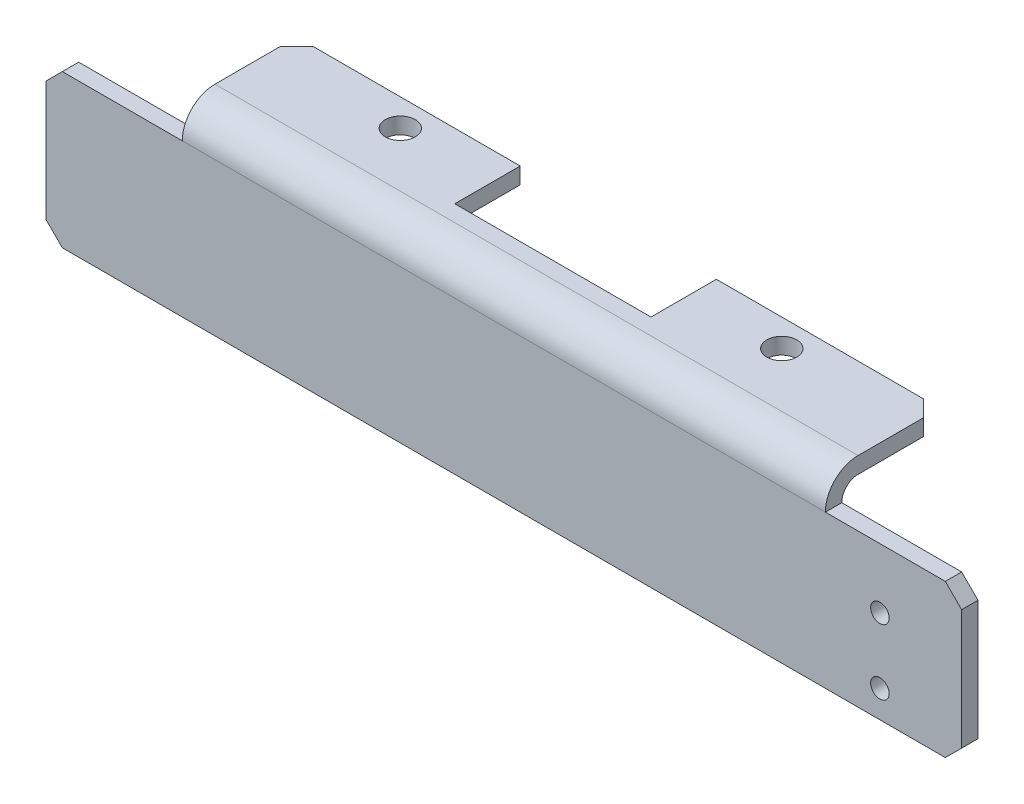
SolidWorks part; units mm, degrees
ref_plane "Спереди" through (0, 0, 0) normal (0, 0, 1) x (1, 0, 0)
ref_plane "Сверху" through (0, 0, 0) normal (0, 1, 0) x (1, 0, 0)
ref_plane "Справа" through (0, 0, 0) normal (1, 0, 0) x (0, 0, -1)
sketch "Эскиз1" plane through (0, 0, 0) normal (1, 0, 0) x (0, 0, -1)
  line L0 (-3.3726, 1.9815) -> (-3.3726, -26.0185)
  line L2 (-0.3726, 1.9815) -> (-0.3726, -26.0185)
  line L3 (-0.3726, -26.0185) -> (-3.3726, -26.0185)
  line L5 (2.6274, 4.9815) -> (17.6274, 4.9815)
  line L7 (2.6274, 7.9815) -> (17.6274, 7.9815)
  line L8 (17.6274, 4.9815) -> (17.6274, 7.9815)
  arc A0 (2.6274, 4.9815) -> (-0.3726, 1.9815) centre (2.6274, 1.9815) ccw
  arc A1 (2.6274, 7.9815) -> (-3.3726, 1.9815) centre (2.6274, 1.9815) ccw
  point P10 (-3.3726, 7.9815)
  dimension "D1" = 3
  dimension "D6" = 6
  dimension "D7" = 26.0185
  dimension "D2" = 3
  dimension "D3" = 3
  dimension "D4" = 34
  dimension "D5" = 21
  dimension "D8" = 0.3726
extrude "Бобышка-Вытянуть1" add sketch "Эскиз1" along normal blind 168
sketch "Эскиз2" plane through (0, 7.9815, 0) normal (0, 1, 0) x (1, 0, 0)
  line L0 (143, 17.6274) -> (168, 17.6274)
  line L1 (168, 17.6274) -> (0, 17.6274) construction
  line L2 (168, 17.6274) -> (168, -3.3726)
  line L3 (168, -3.3726) -> (143, -3.3726)
  line L4 (168, -3.3726) -> (0, -3.3726) construction
  line L5 (143, -3.3726) -> (143, 17.6274)
  line L6 (0, 17.6274) -> (25, 17.6274)
  line L7 (25, 17.6274) -> (25, -3.3726)
  line L8 (25, -3.3726) -> (0, -3.3726)
  line L9 (0, -3.3726) -> (0, 17.6274)
  dimension "D1" = 25
  dimension "D2" = 25
extrude "Вырез-Вытянуть1" cut sketch "Эскиз2" against normal blind 6
sketch "Эскиз3" plane through (0, 7.9815, 0) normal (0, 1, 0) x (1, 0, 0)
  line L0 (66, 17.6274) -> (102, 17.6274)
  line L1 (143, 17.6274) -> (25, 17.6274) construction
  line L2 (102, 17.6274) -> (102, 5.6274)
  line L3 (102, 5.6274) -> (66, 5.6274)
  line L4 (66, 5.6274) -> (66, 17.6274)
  line L5 (25, 2.6274) -> (25, 17.6274) construction
  dimension "D1" = 36
  dimension "D2" = 12
  dimension "D3" = 41
extrude "Вырез-Вытянуть2" cut sketch "Эскиз3" against normal blind 6
sketch "Эскиз4" plane through (0, 7.9815, 0) normal (0, 1, 0) x (1, 0, 0)
  line L0 (143, 17.6274) -> (102, 17.6274) construction
  line L1 (66, 17.6274) -> (25, 17.6274) construction
  line L2 (25, 2.6274) -> (25, 17.6274) construction
  circle A0 centre (49, 12.6274) radius 2.75
  circle A1 centre (119, 12.6274) radius 2.75
  dimension "D1" = 5.5
  dimension "D3" = 5.5
  dimension "D2" = 5
  dimension "D4" = 5
  dimension "D5" = 24
  dimension "D6" = 70
extrude "Вырез-Вытянуть3" cut sketch "Эскиз4" against normal blind 6
sketch "Эскиз5" plane through (0, 0, 3.3726) normal (0, 0, 1) x (1, 0, 0)
  line L0 (168, 1.9815) -> (168, -26.0185) construction
  line L1 (168, -26.0185) -> (0, -26.0185) construction
  circle A0 centre (153, -21.0185) radius 1.7
  circle A1 centre (153, -9.0185) radius 1.7
  dimension "D1" = 3.4
  dimension "D2" = 3.4
  dimension "D3" = 15
  dimension "D4" = 15
  dimension "D5" = 12
  dimension "D6" = 5
extrude "Вырез-Вытянуть4" cut sketch "Эскиз5" against normal blind 6
chamfer "Фаска1" distance 3 angle 45 6 edges at (0, -26.0185, 1.8726) (0, 1.9815, 1.8726) (168, 1.9815, 1.8726) (168, -26.0185, 1.8726) (25, 6.4815, -17.6274) (143, 6.4815, -17.6274)
